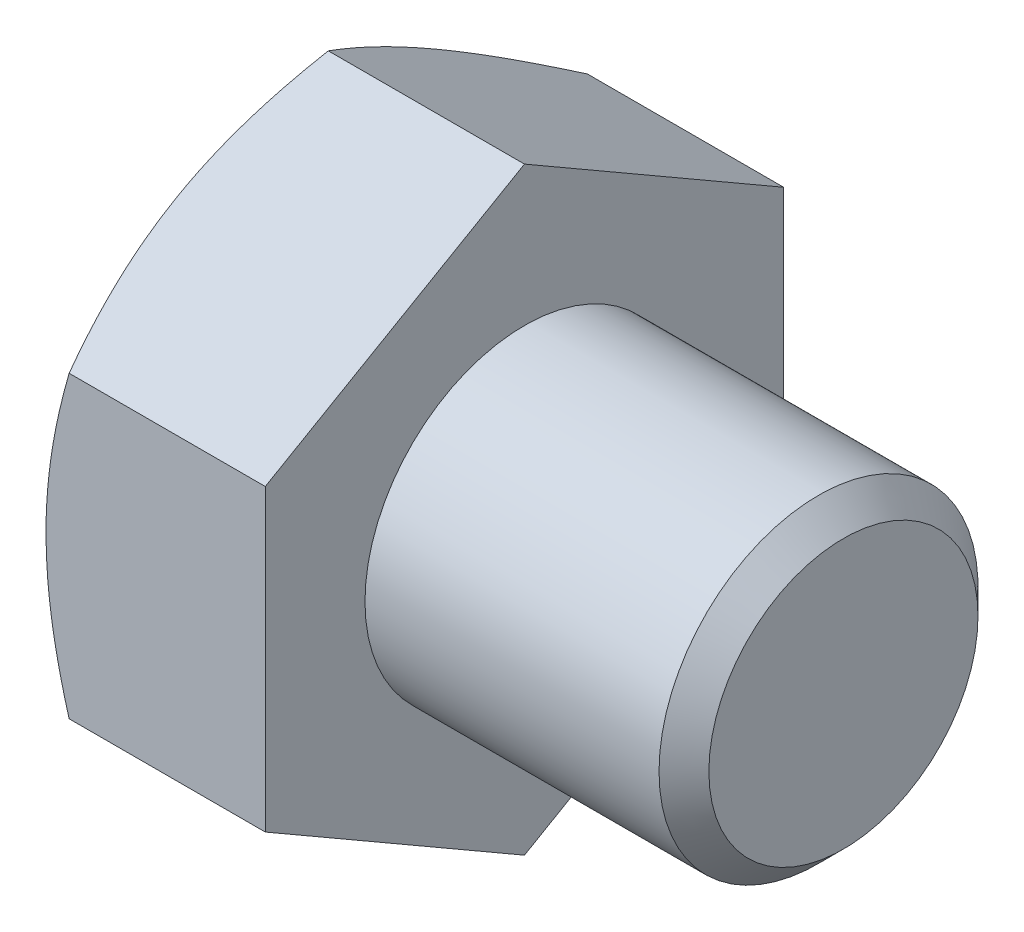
SolidWorks part; units mm, degrees
ref_plane "Front" through (0, 0, 0) normal (0, 0, 1) x (1, 0, 0)
ref_plane "Top" through (0, 0, 0) normal (0, 1, 0) x (1, 0, 0)
ref_plane "Right" through (0, 0, 0) normal (1, 0, 0) x (0, 0, -1)
sketch "Sketch2" plane through (0, 0, 0) normal (1, 0, 0) x (0, 0, -1)
  line L1 (0, 7.5056) -> (-6.5, 3.7528)
  line L2 (-6.5, 3.7528) -> (-6.5, -3.7528)
  line L3 (-6.5, -3.7528) -> (0, -7.5056)
  line L4 (0, -7.5056) -> (6.5, -3.7528)
  line L5 (6.5, -3.7528) -> (6.5, 3.7528)
  line L6 (6.5, 3.7528) -> (0, 7.5056)
  circle A0 centre (0, 0) radius 6.5 construction
  dimension "s" = 13
extrude "Extrude1" add sketch "Sketch2" against normal blind 5.5
sketch "Sketch3" plane through (0, 0, 0) normal (0, 1, 0) x (1, 0, 0)
  line L0 (0, 0) -> (6.8306, 0) construction
  line L1 (0, 0) -> (0, 4)
  line L2 (0, 6.5) -> (0, 0) construction
  line L3 (0, 4) -> (8, 4)
  line L4 (8, 4) -> (8, 0)
  line L5 (8, 0) -> (0, 0)
  line L6 (8, 0) -> (8, -1.25) construction
  dimension "d" = 8
  dimension "L" = 8
  dimension "P" = 1.25
revolve "Revolve1" add sketch "Sketch3" angle 360 about L0
chamfer "Chamfer1" distance 0.625 angle 45 1 edges at (8, 0, 4)
sketch "Sketch4" plane through (0, 0, 0) normal (0, 0, 1) x (1, 0, 0)
  line L0 (-5.5, 6.5) -> (-5.5, 7.5056)
  line L1 (-5.5, 7.5056) -> (-5.5, 3.7528) construction
  line L2 (-5.5, 7.5056) -> (-4.9194, 7.5056)
  line L3 (-4.9194, 7.5056) -> (-5.5, 6.5)
  line L4 (-5.5, 7.5056) -> (0, 7.5056) construction
  line L5 (0, 0) -> (-3.5788, 0) construction
  dimension "D1" = 30
  dimension "D2" = 13
revolve "Cut-Revolve1" cut sketch "Sketch4" angle 360 about L5
equation "\"D1@Chamfer1\" = \"P@Sketch3\" * 0.5"
equation "\"D2@Sketch4\" = \"s@Sketch2\""
